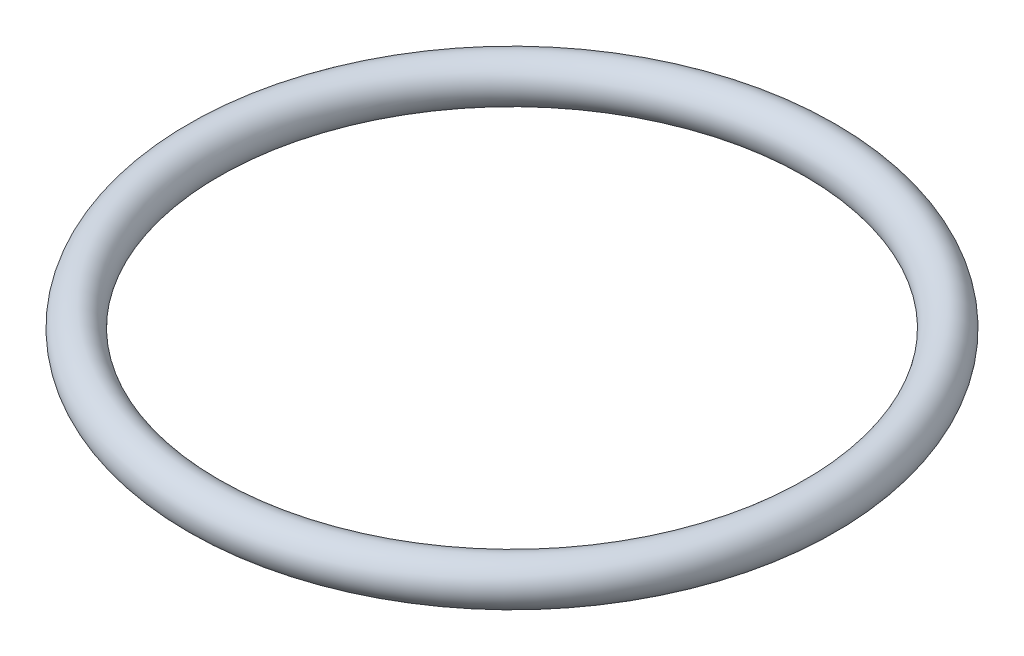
SolidWorks part; units mm, degrees
ref_plane "Front" through (0, 0, 0) normal (0, 0, 1) x (1, 0, 0)
ref_plane "Top" through (0, 0, 0) normal (0, 1, 0) x (1, 0, 0)
ref_plane "Right" through (0, 0, 0) normal (1, 0, 0) x (0, 0, -1)
sketch "Sketch3" plane through (0, 0, 0) normal (1, 0, 0) x (0, 0, -1)
  line L0 (0, 0) -> (0, 32.7991) construction
  circle A0 centre (-12.7953, 0.8382) radius 0.889
  dimension "D3" = 1.778
  dimension "D1" = 0.8382
  dimension "D2" = 25.5905
revolve "Revolve1" add sketch "Sketch3" angle 360 about L0
